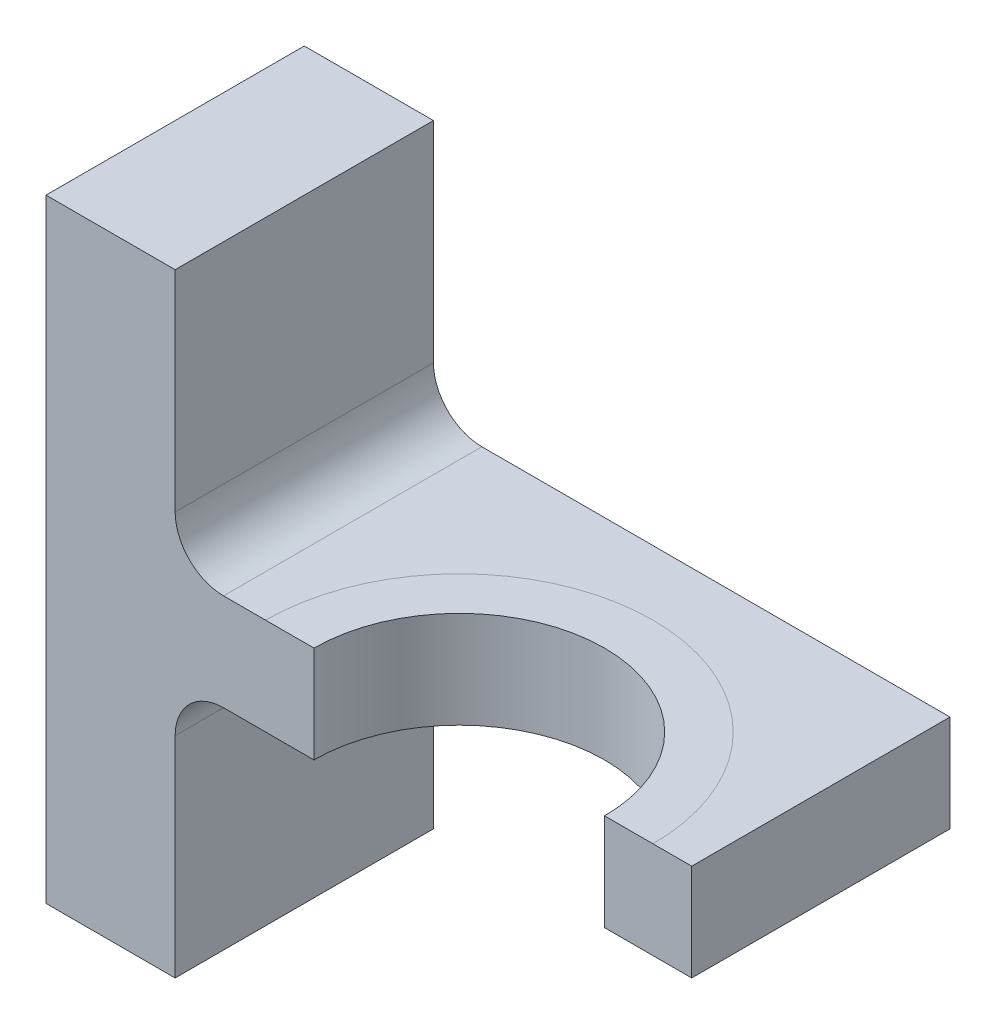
SolidWorks part; units mm, degrees
ref_plane "Front" through (0, 0, 0) normal (0, 0, 1) x (1, 0, 0)
ref_plane "Top" through (0, 0, 0) normal (0, 1, 0) x (1, 0, 0)
ref_plane "Right" through (0, 0, 0) normal (1, 0, 0) x (0, 0, -1)
sketch "Sketch1" plane through (0, 0, 0) normal (0, 0, 1) x (1, 0, 0)
  line L0 (-37.5011, 0) -> (161.7614, 0) construction
  line L1 (0, -60.325) -> (25.4, -60.325)
  line L2 (0, 60.325) -> (25.4, 60.325)
  line L3 (0, 60.325) -> (0, -60.325)
  line L4 (25.4, -60.325) -> (25.4, -9.525)
  line L5 (25.4, -9.525) -> (127, -9.525)
  line L6 (25.4, 9.525) -> (127, 9.525)
  line L7 (127, 9.525) -> (127, -9.525)
  line L8 (25.4, 60.325) -> (25.4, 9.525)
  point P13 (25.4, 9.525)
  point P15 (25.4, -9.525)
  dimension "D1" = 25.4
  dimension "D2" = 120.65
  dimension "D4" = 19.05
  dimension "D5" = 101.6
extrude "Base-Extrude" add sketch "Sketch1" along normal mid plane 101.6
sketch "Sketch6" plane through (0, 0, 0) normal (0, 1, 0) x (1, 0, 0)
  line L0 (-21.254, 0) -> (140.9841, 0) construction
  line L7 (127, -50.8) -> (127, 50.8) construction
  circle A0 centre (81.28, 0) radius 28.575
  dimension "D1" = 57.15
  dimension "D2" = 45.72
extrude "Cut-Extrude8" cut sketch "Sketch6" against normal through all and the other way through all
sketch "Sketch8" plane through (0, 0, 50.8) normal (0, 0, 1) x (1, 0, 0)
  line L0 (-21.5788, 0) -> (140.8806, 0) construction
  line L1 (0, 44.45) -> (6.35, 44.45)
  line L2 (0, 60.325) -> (0, -60.325) construction
  line L3 (0, -44.45) -> (6.35, -44.45)
  line L4 (6.35, 44.45) -> (6.35, -44.45)
  line L5 (0, 44.45) -> (0, -44.45)
  dimension "D1" = 6.35
  dimension "D2" = 88.9
extrude "Cut-Extrude6" [suppressed] cut sketch "Sketch8" against normal through all
sketch "Sketch10" plane through (0, 9.525, 0) normal (0, 1, 0) x (-1, 0, 0)
  circle A0 centre (-81.28, 0) radius 38.1
  circle A1 centre (-81.28, 0) radius 28.575 construction
  dimension "D1" = 76.2
fillet "Fillet6" radius 9.525 2 edges at (25.4, -9.525, 0) (25.4, 9.525, 0)
fillet "Fillet7" [suppressed] radius 6.35
fillet "Fillet8" [suppressed] radius 1.27
sketch "Sketch9" plane through (0, 0, 0) normal (0, 1, 0) x (1, 0, 0)
  line L0 (-41.9226, 0) -> (152.8275, 0)
extrude "symmetry cut" cut sketch "Sketch9" against normal through all and the other way through all flip side to cut
